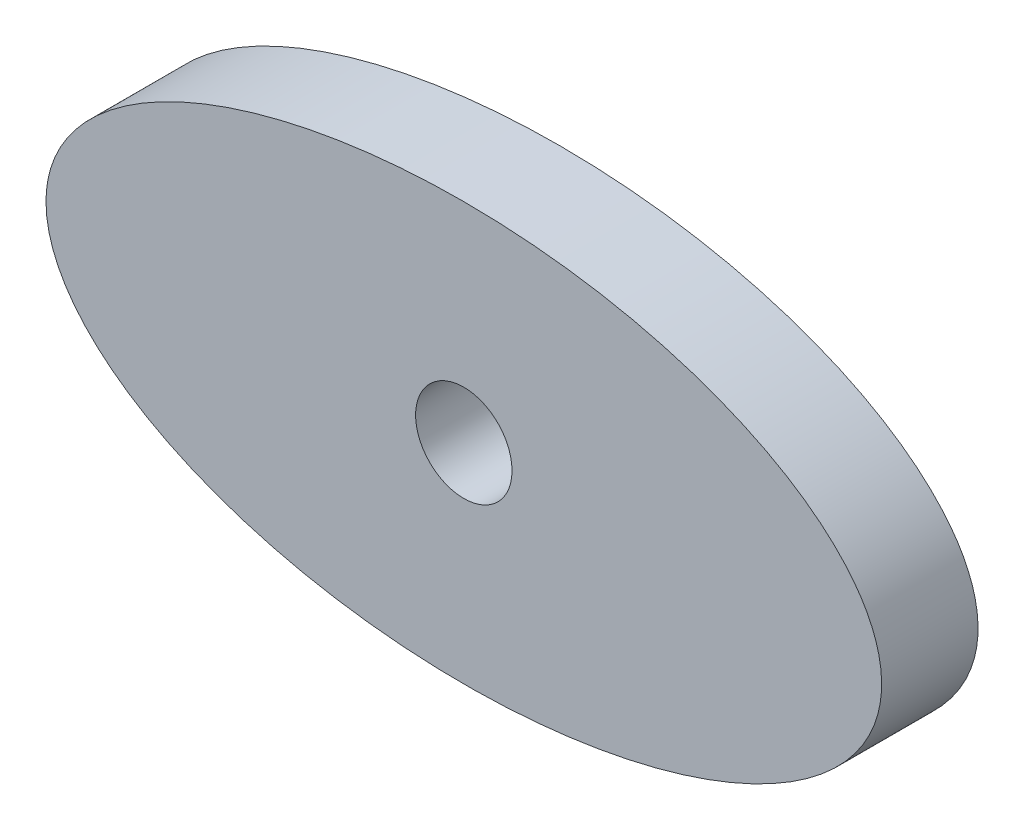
SolidWorks part; units mm, degrees
ref_plane "Ebene vorne" through (0, 0, 0) normal (0, 0, 1) x (1, 0, 0)
ref_plane "Ebene oben" through (0, 0, 0) normal (0, 1, 0) x (1, 0, 0)
ref_plane "Ebene rechts" through (0, 0, 0) normal (1, 0, 0) x (0, 0, -1)
sketch "Skizze1" plane through (0, 0, 0) normal (0, 0, 1) x (1, 0, 0)
  circle A0 centre (0, 0) radius 7.5
  ellipse E0 centre (0, 0) end of major axis (-65, 0) minor radius 32.5
  dimension "D1" = 15
  dimension "D2" = 130
  dimension "D3" = 65
extrude "Linear austragen1" add sketch "Skizze1" along normal mid plane 15
equation "\"LÄNGE\"=0"
equation "\"BREITE\"=0"
equation "\"HÖHE\"=0"
equation "\"DURCHMESSER\"=0"
equation "\"Stückzahl\"= 1"
